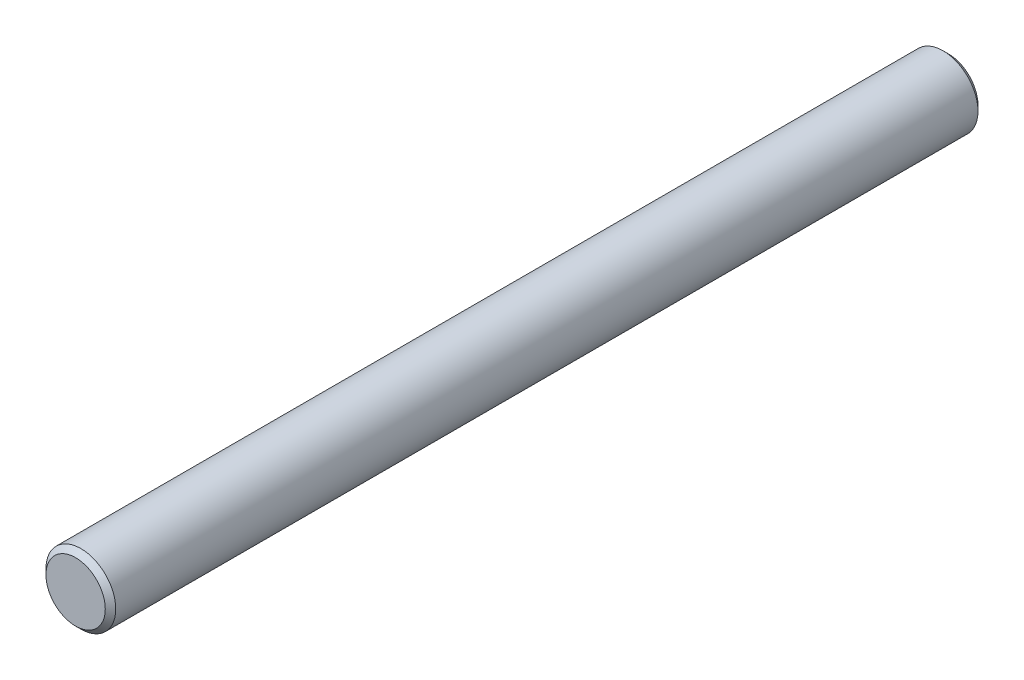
SolidWorks part; units mm, degrees
ref_plane "Front" through (0, 0, 0) normal (0, 0, 1) x (1, 0, 0)
ref_plane "Top" through (0, 0, 0) normal (0, 1, 0) x (1, 0, 0)
ref_plane "Right" through (0, 0, 0) normal (1, 0, 0) x (0, 0, -1)
sketch "Esquisse1" plane through (0, 0, 0) normal (0, 0, 1) x (1, 0, 0)
  circle A0 centre (0, 0) radius 2
  dimension "D1" = 4
extrude "Boss.-Extru.1" add sketch "Esquisse1" along normal blind 50
chamfer "Chanfrein1" distance 0.3 angle 45 2 edges at (2, 0, 0) (2, 0, 50)
